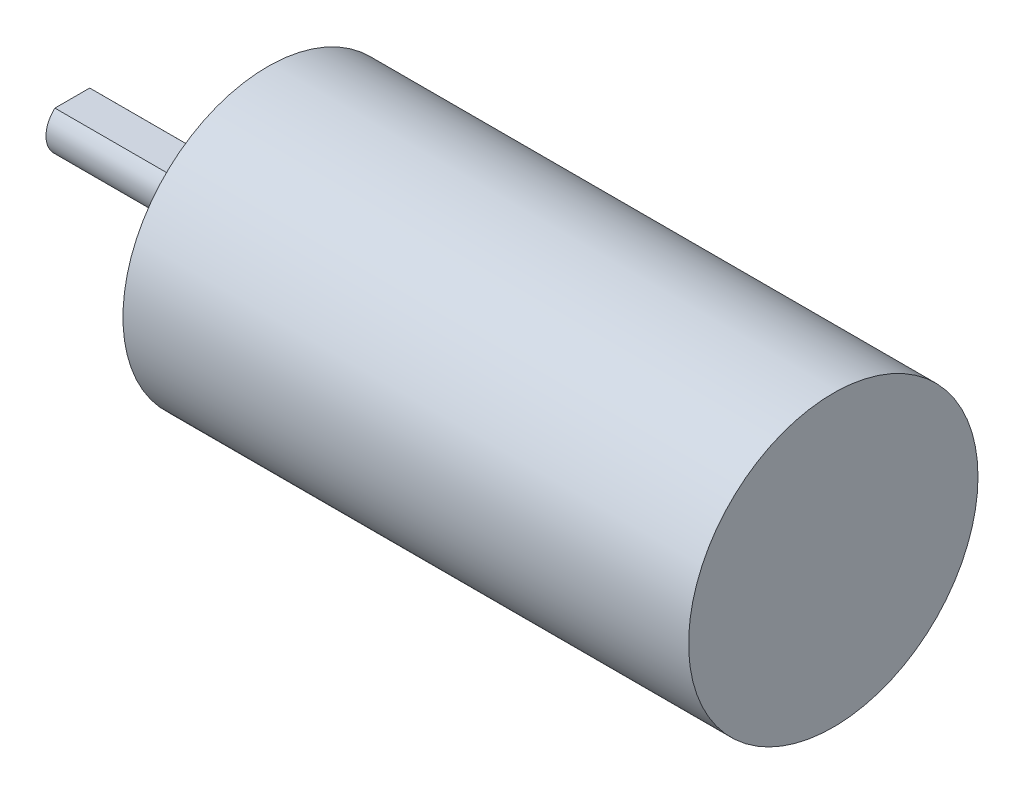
SolidWorks part; units mm, degrees
ref_plane "Front" through (0, 0, 0) normal (0, 0, 1) x (1, 0, 0)
ref_plane "Top" through (0, 0, 0) normal (0, 1, 0) x (1, 0, 0)
ref_plane "Right" through (0, 0, 0) normal (1, 0, 0) x (0, 0, -1)
imported_body "Imported1"
sketch "Sketch1" plane through (60.65, 0, 0) normal (1, 0, 0) x (0, 0, -1)
  circle A1 centre (0, 0) radius 11 construction
  circle A2 centre (0, 0) radius 11
extrude "Cut-Extrude1" cut sketch "Sketch1" against normal blind 2.8
